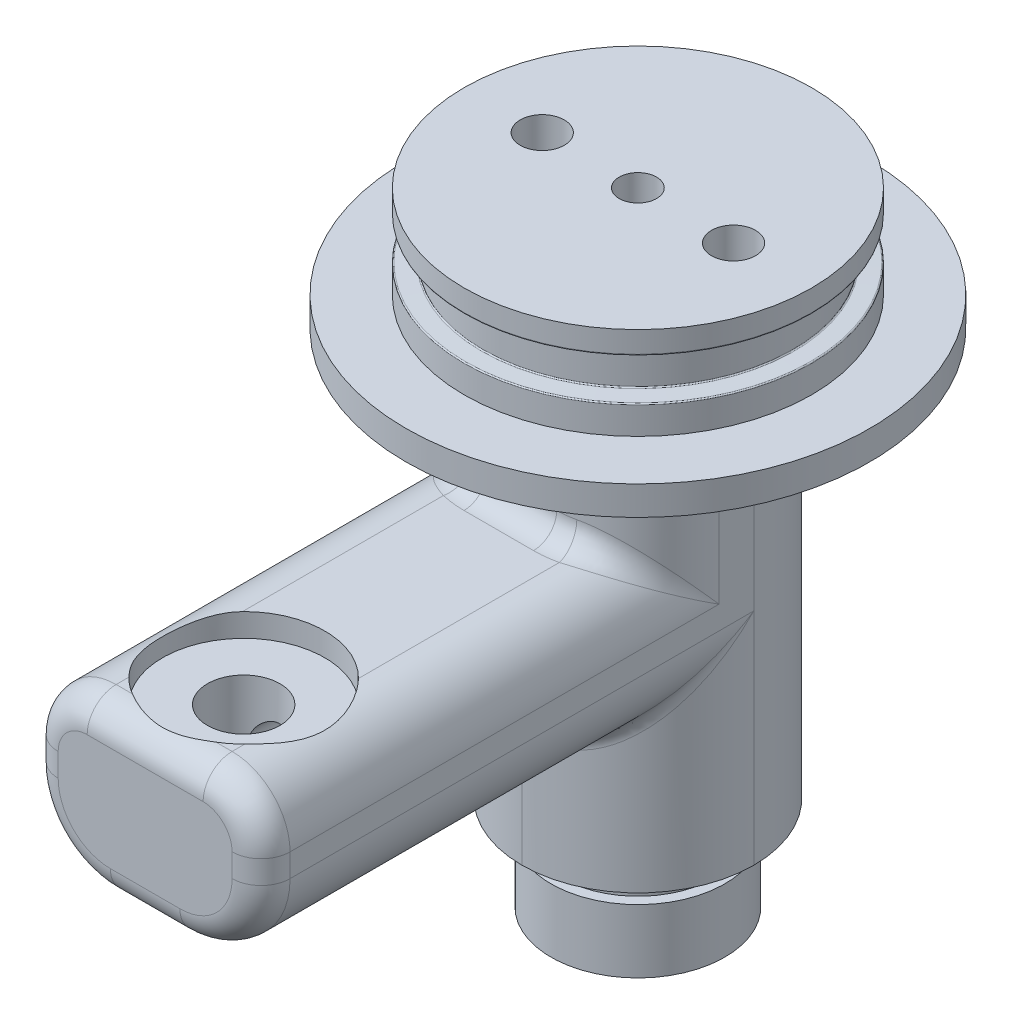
SolidWorks part; units mm, degrees
ref_plane "Plane1" through (0, 0, 0) normal (0, 0, 1) x (1, 0, 0)
ref_plane "Plane2" through (0, 0, 0) normal (0, 1, 0) x (1, 0, 0)
ref_plane "Plane3" through (0, 0, 0) normal (1, 0, 0) x (0, 0, -1)
sketch "Sketch2" plane through (0, 0, 0) normal (0, 0, 1) x (1, 0, 0)
  line L0 (0, 0) -> (19.0246, 0)
  line L1 (19.0246, 0) -> (19.0246, -2.3424)
  line L2 (0, 3.048) -> (0, -18.288) construction
  line L3 (17.1141, -2.5474) -> (18.9031, -2.4693)
  line L4 (0, 0) -> (0, -15.0114)
  line L5 (19.0246, -7.1572) -> (19.0246, -10.1346)
  line L6 (19.0246, -10.1346) -> (25.4, -10.1346)
  line L7 (25.4, -10.1346) -> (25.4, -13.3144)
  line L8 (19.0669, -15.0114) -> (0, -15.0114)
  line L9 (17.1141, -6.9522) -> (18.9031, -7.0303)
  line L10 (19.0669, -15.0114) -> (25.4, -13.3144)
  line L14 (16.9926, -6.8253) -> (16.9926, -2.6743)
  arc A0 (16.9926, -6.8253) -> (17.1141, -6.9522) centre (17.1196, -6.8253) ccw
  arc A1 (17.1141, -2.5474) -> (16.9926, -2.6743) centre (17.1196, -2.6743) ccw
  arc A2 (19.0246, -2.3424) -> (18.9031, -2.4693) centre (18.8976, -2.3424) cw
  arc A3 (18.9031, -7.0303) -> (19.0246, -7.1572) centre (18.8976, -7.1572) cw
  point P21 (16.9926, -4.7498)
revolve "Base-Revolve" add sketch "Sketch2" angle 360 about L2
sketch "Sketch8" plane through (0, -15.0114, 0) normal (0, -1, 0) x (1, 0, 0)
  line L0 (12.7, 12.7) -> (-12.7, 12.7)
  line L1 (12.7, -12.7) -> (-12.7, -12.7)
  line L3 (12.7, 12.7) -> (12.7, -12.7)
  line L5 (-12.7, -12.7) -> (-12.7, 12.7)
extrude "Boss-Extrude1" add sketch "Sketch8" along normal blind 42.9006
sketch "Sketch9" plane through (0, -57.912, 0) normal (0, -1, 0) x (1, 0, 0)
  circle A0 centre (0, 0) radius 8.4074
extrude "Boss-Extrude2" add sketch "Sketch9" along normal blind 3.3528
sketch "Sketch10" plane through (0, -61.2648, 0) normal (0, -1, 0) x (1, 0, 0)
  circle A0 centre (0, 0) radius 9.525
extrude "Boss-Extrude3" add sketch "Sketch10" along normal blind 6.9596
sketch "Sketch11" plane through (0, -68.2244, 0) normal (0, -1, 0) x (1, 0, 0)
  circle A0 centre (0, 0) radius 4.845
extrude "Cut-Extrude1" cut sketch "Sketch11" against normal blind 12.8016
sketch "Sketch12" plane through (0, -55.4228, 0) normal (0, -1, 0) x (1, 0, 0)
  circle A0 centre (0, 0) radius 2.0447
extrude "Cut-Extrude2" cut sketch "Sketch12" against normal through all
sketch "Sketch13" plane through (0, 0, 12.7) normal (0, 0, 1) x (1, 0, 0)
  line L3 (12.7, -42.672) -> (-12.7, -42.672)
  line L6 (-12.7, -57.912) -> (-12.7, -15.0114) construction
  line L7 (-12.7, -24.892) -> (12.7, -24.892)
  line L8 (-12.7, -24.892) -> (-12.7, -42.672)
  line L10 (12.7, -24.892) -> (12.7, -42.672)
extrude "Boss-Extrude4" add sketch "Sketch13" along normal blind 41.275
sketch "Sketch14" plane through (0, -24.892, 0) normal (0, 1, 0) x (-1, 0, 0)
  circle A0 centre (0, 43.18) radius 8.89
extrude "Cut-Extrude3" cut sketch "Sketch14" against normal blind 2.54
sketch "Sketch27" plane through (0, 0, -12.7) normal (0, 0, -1) x (-1, 0, 0)
  line L1 (0, -61.2648) -> (0, -57.912) construction
  circle A0 centre (0, -33.782) radius 2.54
extrude "Cut-Extrude9" cut sketch "Sketch27" against normal blind 58.42
sketch "Sketch28" plane through (0, -27.432, 0) normal (0, 1, 0) x (-1, 0, 0)
  circle A0 centre (0, 43.18) radius 3.9688
extrude "Cut-Extrude10" cut sketch "Sketch28" against normal blind 10.668
sketch "Sketch29" plane through (0, 0, -12.7) normal (0, 0, -1) x (-1, 0, 0)
  circle A0 centre (0, -33.782) radius 6.35
extrude "Cut-Extrude11" cut sketch "Sketch29" against normal blind 3.175
fillet "Fillet1" radius 12.7
fillet "Fillet2" radius 12.7
fillet "Fillet5" radius 8.89
fillet "Fillet6" radius 8.89
sketch "Sketch30" plane through (0, 0, 0) normal (0, 1, 0) x (-1, 0, 0)
  circle A0 centre (-10.4775, 0) radius 2.413
  circle A1 centre (10.4775, 0) radius 2.413
extrude "Cut-Extrude12" cut sketch "Sketch30" against normal blind 5.334
fillet "Fillet12" radius 8.89
fillet "Fillet13" radius 8.89
fillet "Fillet15" radius 6.35
fillet "Fillet16" radius 6.35
fillet "Fillet17" radius 3.175
fillet "Fillet18" radius 2.54
fillet "Fillet19" radius 2.54
sketch "Sketch31" plane through (0, 0, -9.525) normal (0, 0, -1) x (-1, 0, 0)
  circle A0 centre (0, -33.782) radius 3.9688
extrude "Cut-Extrude13" cut sketch "Sketch31" against normal blind 8.89
fillet "Fillet23" radius 12.7
fillet "Fillet24" radius 12.7
